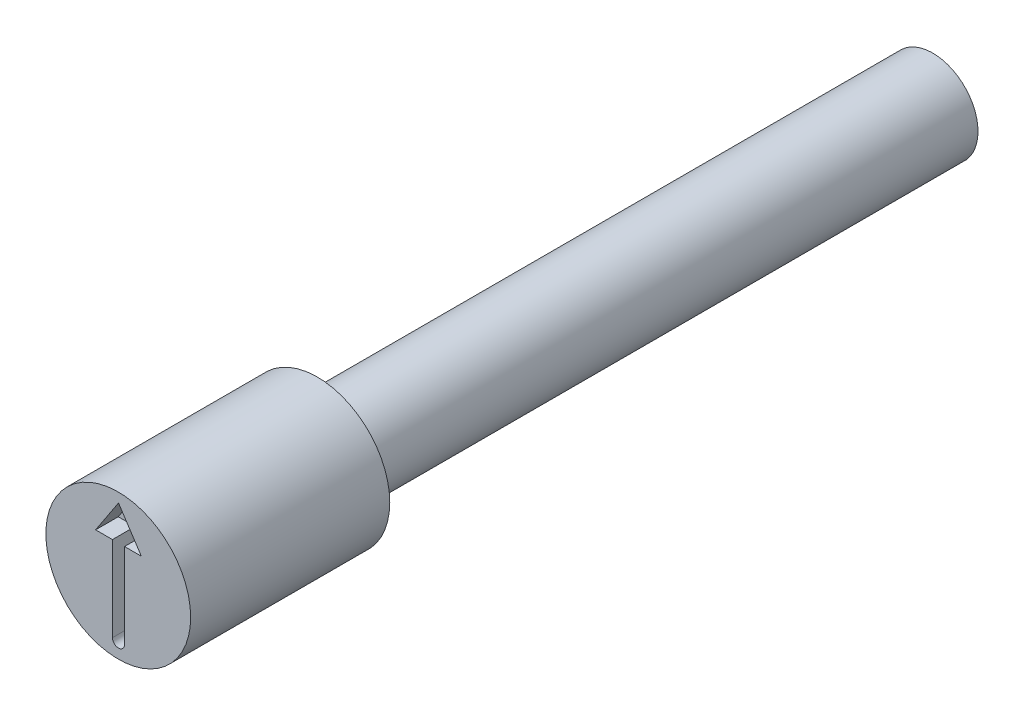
SolidWorks part; units mm, degrees
ref_plane "Front Plane" through (0, 0, 0) normal (0, 0, 1) x (1, 0, 0)
ref_plane "Top Plane" through (0, 0, 0) normal (0, 1, 0) x (1, 0, 0)
ref_plane "Right Plane" through (0, 0, 0) normal (1, 0, 0) x (0, 0, -1)
sketch "Sketch2" plane through (0, 0, 0) normal (1, 0, 0) x (0, 0, -1)
  line L0 (0.4039, 0) -> (50000.4039, 0) construction
  line L6 (0, 0.8) -> (0, 0)
  line L7 (2.2, 0.8) -> (0, 0.8)
  line L8 (2.2, 0.5) -> (2.2, 0.8)
  line L9 (9, 0.5) -> (2.2, 0.5)
  line L10 (9, 0) -> (9, 0.5)
  line L11 (0, 0) -> (9, 0)
  dimension "D1" = 1.6
  dimension "D2" = 1
  dimension "D3" = 9
  dimension "D4" = 2.2
revolve "Revolve1" add sketch "Sketch2" angle 360 about L0
sketch "Sketch3" plane through (0, 0, 0) normal (0, 0, 1) x (1, 0, 0)
  line L0 (0.0025, -0.0048) -> (0.0025, 34999.9952) construction
  line L1 (0.0692, 0.3124) -> (0.0692, -0.6265)
  line L2 (0.2552, 0.3124) -> (0.0692, 0.3124)
  line L3 (0.0025, 0.6959) -> (0.2552, 0.3124)
  line L4 (0.0025, 0.6959) -> (-0.2502, 0.3124)
  line L5 (-0.2502, 0.3124) -> (-0.0642, 0.3124)
  line L6 (-0.0642, 0.3124) -> (-0.0642, -0.6265)
  arc A0 (-0.0642, -0.6265) -> (0.0692, -0.6265) centre (0.0025, -0.6265) ccw
extrude "Cut-Extrude4" cut sketch "Sketch3" against normal blind 0.25
